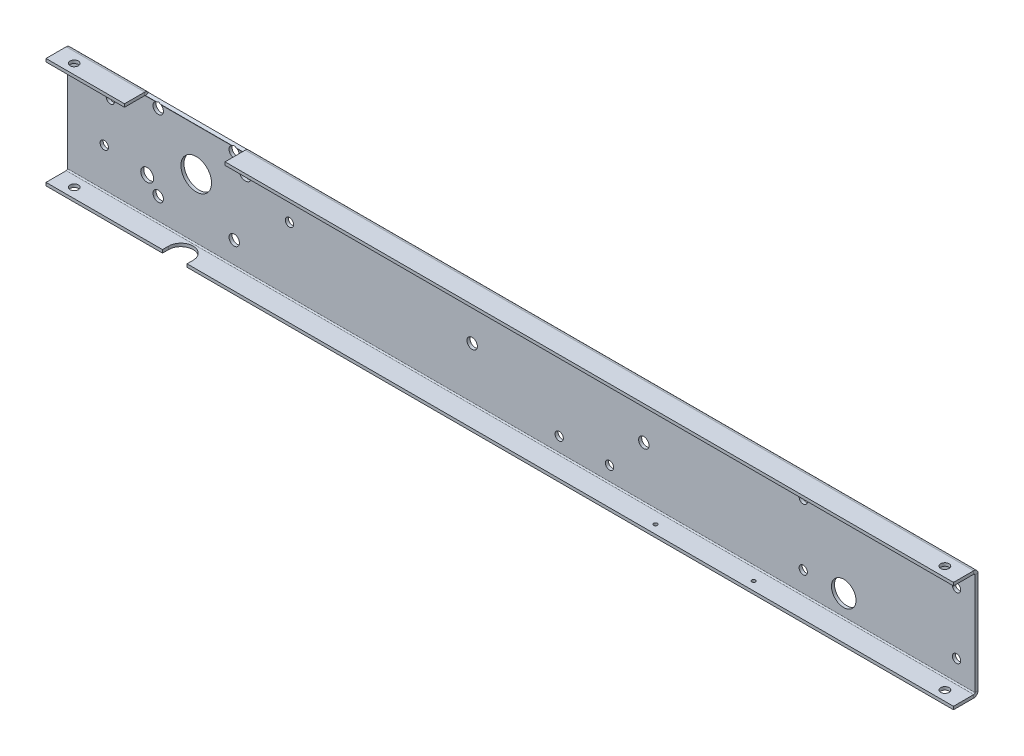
SolidWorks part; units mm, degrees
ref_plane "Plan de face" through (0, 0, 0) normal (0, 0, 1) x (1, 0, 0)
ref_plane "Plan de dessus" through (0, 0, 0) normal (0, 1, 0) x (1, 0, 0)
ref_plane "Plan de droite" through (0, 0, 0) normal (1, 0, 0) x (0, 0, -1)
mirrored part "DF030818-1_Rendre symétrique"
other "<DF030818-1>-<Diamètre du perçage M3.0 (3.000000)1>"
